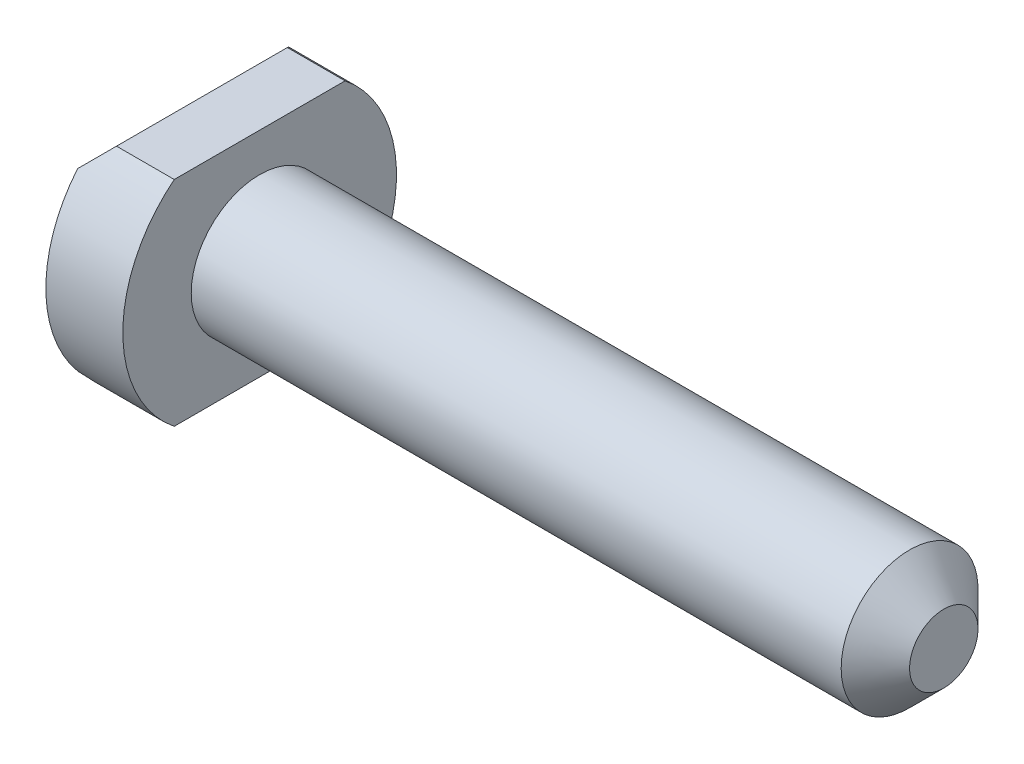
SolidWorks part; units mm, degrees
ref_plane "Front Plane" through (0, 0, 0) normal (0, 0, 1) x (1, 0, 0)
ref_plane "Top Plane" through (0, 0, 0) normal (0, 1, 0) x (1, 0, 0)
ref_plane "Right Plane" through (0, 0, 0) normal (1, 0, 0) x (0, 0, -1)
sketch "BaseHeadSke" plane through (0, 0, 0) normal (1, 0, 0) x (0, 0, -1)
  line L0 (-25.8903, 0) -> (25.0813, 0) construction
  line L1 (0, 0) -> (0, 16) construction
  line L2 (-9.9875, 12.5) -> (9.9875, 12.5)
  line L3 (-9.9875, -12.5) -> (9.9875, -12.5)
  arc A0 (-9.9875, 12.5) -> (-9.9875, -12.5) centre (0, 0) ccw
  arc A1 (9.9875, -12.5) -> (9.9875, 12.5) centre (0, 0) ccw
  dimension "Head_dia" = 32
  dimension "Head_width" = 25
  dimension "Nominal_Size" = 16
extrude "BaseHead" add sketch "BaseHeadSke" along normal blind 9
chamfer "HeadChamfer" distance 2.25 2 edges at (0, -12.5, 0) (0, 12.5, 0)
sketch "BodySke" plane through (0, 0, 0) normal (0, 0, 1) x (1, 0, 0)
  line L0 (0, 0) -> (98.0537, 0) construction
  line L1 (0, 10.25) -> (0, -10.25) construction
  line L2 (85, 8) -> (89, 4)
  line L3 (0, 0) -> (89, 0)
  line L4 (0, 0) -> (0, 8)
  line L5 (0, 8) -> (85, 8)
  line L6 (89, 0) -> (89, 4)
  line L7 (9, -12.5) -> (9, 12.5) construction
  line L8 (34, 0) -> (34, 11.0908) construction
  line L9 (11, 0) -> (11, 16.7727) construction
  line L10 (29, 0) -> (29, 8) construction
  point P14 (0, 6.8985)
  dimension "D1" = 5
  dimension "Length" = 80
  dimension "Thread_length" = 55
  dimension "Diameter" = 16
  dimension "Chamfer_end_width" = 4
  dimension "Chamfer_end_angle" = 45
  dimension "Advance" = 2
  dimension "Thread_minor" = 13.797
revolve "BaseBody" add sketch "BodySke" angle 360 about L0
sketch "BoltSke" plane through (0, 0, 0) normal (0, 0, 1) x (1, 0, 0)
  line L0 (0, 0) -> (90.6713, 0) construction
  line L1 (0, 0) -> (98.0537, 0) construction
  line L2 (9, 0) -> (9, 8)
  line L5 (9, -12.5) -> (9, 12.5) construction
  line L7 (9, 8) -> (29, 8)
  line L11 (9, 0) -> (29, 0)
  line L12 (29, 8) -> (29, 0)
  line L13 (29, 0) -> (29, 8) construction
  dimension "Nominal_Size" = 16
revolve "Bolt" add sketch "BoltSke" angle 360 about L0
sketch "ThdSchSke" plane through (0, 0, 0) normal (0, 0, 1) x (1, 0, 0)
  line L0 (0, 0) -> (92.3539, 0) construction
  line L1 (0, 0) -> (98.0537, 0) construction
  line L2 (83, 9.2719) -> (83, 8)
  line L3 (83, 9.2719) -> (84.2719, 9.2719)
  line L4 (84.2719, 9.2719) -> (84.2719, 8)
  line L5 (84.2719, 8) -> (83.636, 6.8985)
  line L6 (83.636, 6.8985) -> (83, 8)
  dimension "D1" = 2
revolve "ThreadSchematic" [suppressed] cut sketch "ThdSchSke" angle 360 about L0
pattern_linear "ThdSchPat" [suppressed]
equation "\"D1@HeadChamfer\" = \"Head_height@BaseHead\" * 0.25"
equation "\"D1@BodySke\" = 2.5 * \"Advance@BodySke\""
equation "\"Thread_minor@ThreadCosmetic\" = \"Thread_minor@BodySke\""
equation "\"Thread_length@ThreadCosmetic\" = \"Thread_length@BodySke\" - \"Chamfer_end_width@BodySke\""
equation "\"D1@ThdSchSke\" = \"Advance@BodySke\""
equation "\"Nominal_Size@BoltSke\" = \"Nominal_Size@BaseHeadSke\""
equation "\"Advance@ThdSchPat\" = \"Advance@BodySke\""
equation "\"Tooth_Num@ThdSchPat\" =  int( (  \"Thread_length@BodySke\" - \"Chamfer_end_width@BodySke\" )  / \"Advance@BodySke\" ) "
